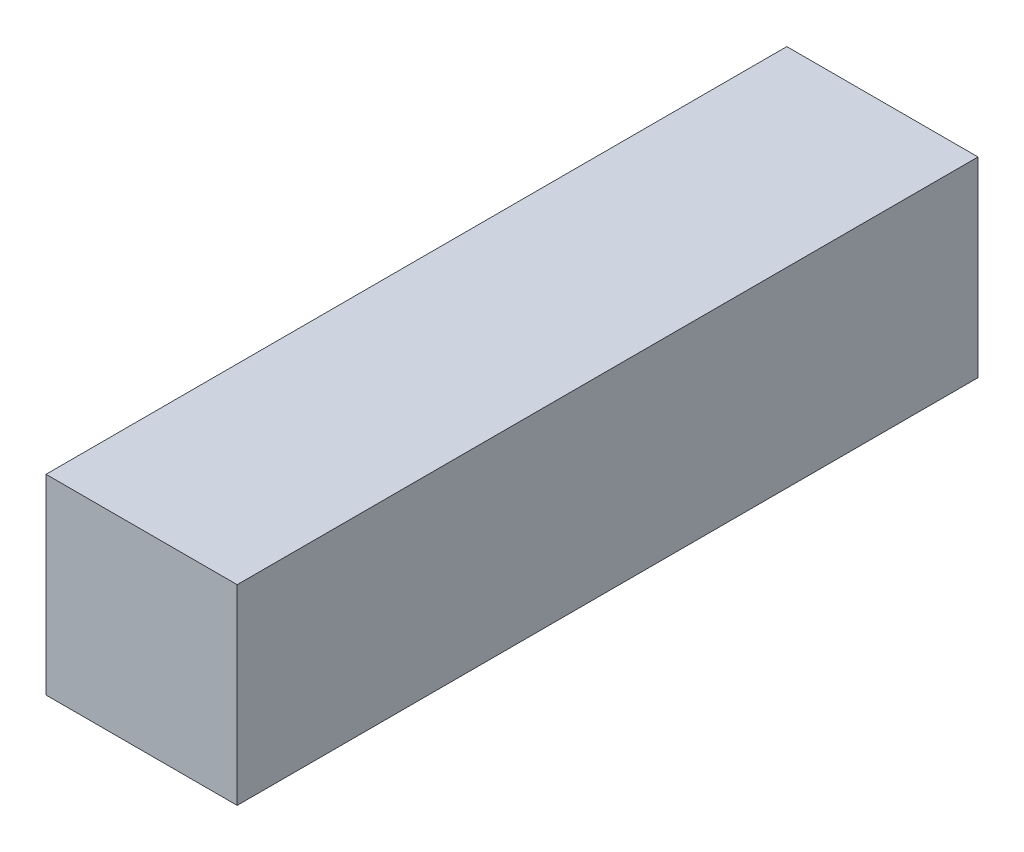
SolidWorks part; units mm, degrees
ref_plane "Front Plane" through (0, 0, 0) normal (0, 0, 1) x (1, 0, 0)
ref_plane "Top Plane" through (0, 0, 0) normal (0, 1, 0) x (1, 0, 0)
ref_plane "Right Plane" through (0, 0, 0) normal (1, 0, 0) x (0, 0, -1)
sketch "Sketch1" plane through (0, 0, 0) normal (0, 1, 0) x (1, 0, 0)
  line L0 (-1, -7.25) -> (1, -7.25)
  line L1 (1, -7.25) -> (1, 7.25)
  line L2 (-2, 7.25) -> (-1, 7.25)
  line L3 (-1, 7.25) -> (-1, -7.25)
  line L4 (2, -7.25) -> (2, 7.25)
  line L5 (-2, 7.25) -> (-2, -8.25)
  line L6 (-2, -8.25) -> (1, -8.25)
  line L7 (2, -7.25) -> (2, -8.25)
  line L8 (2, -8.25) -> (1, -8.25)
  line L9 (1, 7.25) -> (2, 7.25)
  dimension "D1" = 1
  dimension "D2" = 1
extrude "Boss-Extrude1" add sketch "Sketch1" along normal blind 3
sketch "Sketch2" plane through (0, 3, 0) normal (0, 1, 0) x (1, 0, 0)
  line L0 (-2, 7.25) -> (2, 7.25)
  line L1 (2, 7.25) -> (2, -8.25)
  line L2 (2, -8.25) -> (-2, -8.25)
  line L3 (-2, -8.25) -> (-2, 7.25)
extrude "Boss-Extrude2" add sketch "Sketch2" along normal blind 1
sketch "Sketch3" plane through (0, 0, 0) normal (0, -1, 0) x (1, 0, 0)
  line L0 (-1, 7.25) -> (1, 7.25)
  line L1 (1, 7.25) -> (1, -7.25)
  line L2 (1, -7.25) -> (1.5, -7.25)
  line L3 (2, -7.25) -> (1, -7.25) construction
  line L4 (-1, 7.25) -> (-1, -7.25)
  line L5 (-1, -7.25) -> (-1.5, -7.25)
  line L6 (-1, -7.25) -> (-2, -7.25) construction
  line L7 (-1.5, -7.25) -> (-1.5, 7.7172)
  line L8 (-1.5, 7.7172) -> (1.5, 7.7172)
  line L9 (1.5, 7.7172) -> (1.5, -7.25)
extrude "Cut-Extrude1" cut sketch "Sketch3" against normal blind 0.25
extrude "Cut-Extrude7" cut sketch "Sketch9" against normal blind 6
sketch "Sketch9" plane through (31.1685, -3, 26.5462) normal (0, -1, 0) x (-0.7071, 0, 0.7071)
  line L2 (7.62, 34.2129) -> (9.8656, 36.4585)
  line L3 (9.8479, 36.4761) -> (-10.674, 56.998)
  line L4 (9.8479, 36.4761) -> (9.8656, 36.4585)
  line L5 (7.6028, 34.2311) -> (-12.919, 54.753)
  line L6 (-10.674, 56.998) -> (-12.919, 54.753)
  line L8 (7.62, 34.2129) -> (7.6028, 34.2311)
